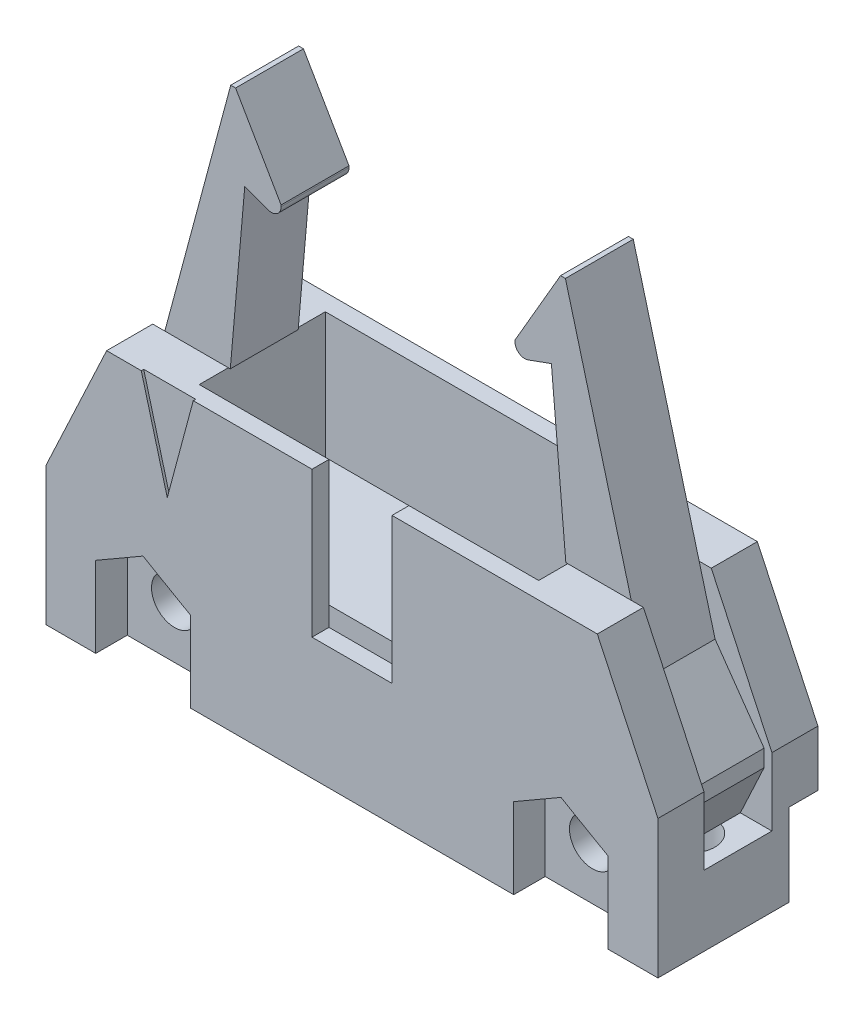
SolidWorks part; units mm, degrees
ref_plane "Front Plane" through (0, 0, 0) normal (0, 0, 1) x (1, 0, 0)
ref_plane "Top Plane" through (0, 0, 0) normal (0, 1, 0) x (1, 0, 0)
ref_plane "Right Plane" through (0, 0, 0) normal (1, 0, 0) x (0, 0, -1)
sketch "Sketch1" plane through (0, 0, 0) normal (0, 0, 1) x (1, 0, 0)
  line L1 (0, 0) -> (32.0548, 0)
  line L2 (0, 0) -> (0, 14.0208)
  line L3 (0, 14.0208) -> (32.0548, 14.0208)
  line L4 (32.0548, 0) -> (32.0548, 14.0208)
  dimension "D1" = 32.0548
  dimension "D2" = 14.0208
extrude "Base-Extrude" add sketch "Sketch1" against normal blind 8.382
sketch "Sketch2" plane through (0, 0, 0) normal (0, 0, 1) x (1, 0, 0)
  line L0 (16.0274, 14.0208) -> (16.0274, 0) construction
  line L1 (32.0548, 14.0208) -> (0, 14.0208) construction
  line L2 (0, 0) -> (32.0548, 0) construction
  line L3 (3.175, 14.0208) -> (0, 7.239)
  line L4 (0, 14.0208) -> (0, 0) construction
  line L5 (0, 14.0208) -> (0, 7.239)
  line L6 (0, 14.0208) -> (3.175, 14.0208)
  line L7 (32.0548, 14.0208) -> (28.8798, 14.0208)
  line L8 (32.0548, 14.0208) -> (32.0548, 7.239)
  line L9 (28.8798, 14.0208) -> (32.0548, 7.239)
  dimension "D1" = 7.239
  dimension "D2" = 3.175
extrude "Angle Cut Outside" cut sketch "Sketch2" against normal through all
sketch "Sketch3" plane through (0, 14.0208, 0) normal (0, 1, 0) x (-1, 0, 0)
  line L4 (-3.175, -4.191) -> (-28.8798, -4.191) construction
  line L5 (-3.175, -8.382) -> (-3.175, 0) construction
  line L6 (-28.8798, -8.382) -> (-28.8798, 0) construction
  line L7 (-16.0274, 0) -> (-16.0274, -8.382) construction
  line L8 (-28.8798, 0) -> (-3.175, 0) construction
  line L9 (-28.8798, -8.382) -> (-3.175, -8.382) construction
  line L10 (-7.1374, -7.493) -> (-7.1374, -0.889)
  line L11 (-7.1374, -0.889) -> (-24.9174, -0.889)
  line L12 (-24.9174, -7.493) -> (-24.9174, -0.889)
  line L13 (-7.1374, -7.493) -> (-24.9174, -7.493)
  point P16 (-16.0274, -0.889)
  point P18 (-24.9174, -4.191)
  point P19 (-7.1374, -4.191)
  dimension "D1" = 3.302
  dimension "D2" = 8.89
extrude "Inside Cut1" cut sketch "Sketch3" against normal blind 6.604
sketch "Sketch4" plane through (0, 0, 0) normal (0, 0, 1) x (1, 0, 0)
  line L0 (16.0274, 0) -> (16.0274, 14.0208) construction
  line L1 (0, 0) -> (32.0548, 0) construction
  line L2 (28.8798, 14.0208) -> (3.175, 14.0208) construction
  line L3 (13.9319, 14.0208) -> (13.9319, 6.4008)
  line L4 (13.9319, 6.4008) -> (18.1229, 6.4008)
  line L5 (13.9319, 14.0208) -> (18.1229, 14.0208)
  line L6 (18.1229, 14.0208) -> (18.1229, 6.4008)
  point P11 (16.0274, 6.4008)
  dimension "D1" = 2.0955
  dimension "D2" = 7.62
extrude "Center Cut1" cut sketch "Sketch4" against normal blind 0.889
ref_plane "Latch Plane" through (0, 0, -2.413) normal (0, 0, 1) x (1, 0, 0)
sketch "Sketch7" plane through (0, 0, -2.413) normal (0, 0, 1) x (1, 0, 0)
  line L0 (16.0274, 0) -> (16.0274, 14.0208) construction
  line L1 (0, 0) -> (32.0548, 0) construction
  line L2 (24.9174, 14.0208) -> (7.1374, 14.0208) construction
  line L3 (24.0591, 22.6702) -> (24.8158, 14.0208)
  line L4 (13.9319, 14.0208) -> (3.175, 14.0208) construction
  line L5 (7.239, 14.0208) -> (3.81, 14.0208)
  line L6 (3.81, 14.0208) -> (7.2614, 26.9014)
  line L7 (7.2614, 26.9014) -> (7.5154, 26.9014)
  line L8 (7.5154, 26.9014) -> (9.9007, 22.7878)
  line L9 (9.9007, 22.7878) -> (9.9007, 22.7024)
  line L10 (9.219, 22.225) -> (7.9957, 22.6702)
  line L11 (7.9957, 22.6702) -> (7.239, 14.0208)
  line L12 (22.8358, 22.225) -> (24.0591, 22.6702)
  line L13 (22.1541, 22.7878) -> (22.1541, 22.7024)
  line L14 (24.5394, 26.9014) -> (22.1541, 22.7878)
  line L15 (24.7934, 26.9014) -> (24.5394, 26.9014)
  line L16 (28.2448, 14.0208) -> (24.7934, 26.9014)
  line L17 (24.8158, 14.0208) -> (28.2448, 14.0208)
  arc A0 (9.219, 22.225) -> (9.9007, 22.7024) centre (9.3927, 22.7024) ccw
  arc A1 (22.8358, 22.225) -> (22.1541, 22.7024) centre (22.6621, 22.7024) cw
  dimension "D9" = 0.508
  dimension "D1" = 0.635
  dimension "D2" = 13.335
  dimension "D3" = 75
  dimension "D4" = 3.429
  dimension "D5" = 22.225
  dimension "D6" = 85
  dimension "D7" = 0.254
  dimension "D8" = 1.905
  dimension "D10" = 0.762
  dimension "D11" = 75
extrude "Latches" add sketch "Sketch7" against normal blind 3.556
sketch "Sketch8" plane through (0, 0, -2.413) normal (0, 0, 1) x (1, 0, 0)
  line L0 (7.2614, 26.9014) -> (3.81, 14.0208) construction
  line L1 (3.81, 14.0208) -> (2.9747, 10.9033)
  line L2 (16.0274, 0) -> (16.0274, 14.0208) construction
  line L3 (0, 0) -> (32.0548, 0) construction
  line L4 (13.9319, 14.0208) -> (3.175, 14.0208) construction
  line L5 (0.4089, 7.239) -> (2.9747, 10.9033)
  line L6 (0.4089, 7.239) -> (0.4089, 6.35)
  line L7 (1.6525, 3.683) -> (0, 3.683)
  line L8 (0, 7.239) -> (0, 0) construction
  line L9 (0.4089, 6.35) -> (1.6525, 3.683)
  line L10 (0, 7.239) -> (0, 3.683)
  line L11 (0, 7.239) -> (3.175, 14.0208) construction
  line L12 (0, 7.239) -> (3.175, 14.0208)
  line L13 (3.81, 14.0208) -> (3.175, 14.0208)
  line L14 (28.2448, 14.0208) -> (28.8798, 14.0208)
  line L15 (32.0548, 7.239) -> (28.8798, 14.0208)
  line L16 (32.0548, 7.239) -> (32.0548, 3.683)
  line L17 (31.6459, 6.35) -> (30.4023, 3.683)
  line L18 (30.4023, 3.683) -> (32.0548, 3.683)
  line L19 (31.6459, 7.239) -> (31.6459, 6.35)
  line L20 (31.6459, 7.239) -> (29.0801, 10.9033)
  line L21 (28.2448, 14.0208) -> (29.0801, 10.9033)
  dimension "D1" = 3.683
  dimension "D2" = 1.6525
  dimension "D3" = 6.35
  dimension "D4" = 65
  dimension "D5" = 160
extrude "Latch Cut1" cut sketch "Sketch8" against normal blind 3.556
sketch "Sketch9" plane through (0, 0, 0) normal (0, 0, 1) x (1, 0, 0)
  line L0 (4.9888, 14.0208) -> (6.35, 8.9408)
  line L1 (13.9319, 14.0208) -> (3.175, 14.0208) construction
  line L2 (6.35, 8.9408) -> (7.7112, 14.0208)
  line L3 (7.7112, 14.0208) -> (4.9888, 14.0208)
  line L4 (6.35, 14.0208) -> (6.35, 0) construction
  line L5 (0, 0) -> (32.0548, 0) construction
  dimension "D1" = 30
  dimension "D2" = 6.35
  dimension "D3" = 5.08
extrude "Pin 1 Triangle Cut" cut sketch "Sketch9" against normal blind 0.127
sketch "Sketch10" plane through (0, 0, 0) normal (0, 0, 1) x (1, 0, 0)
  line L0 (16.0274, 0) -> (16.0274, 14.0208) construction
  line L1 (0, 0) -> (32.0548, 0) construction
  line L2 (24.9174, 14.0208) -> (7.1374, 14.0208) construction
  line L3 (5.9524, 0.4381) -> (7.3994, 1.2735)
  line L4 (2.271, 1.5562) -> (3.718, 0.7208)
  line L5 (7.5565, 0) -> (7.5565, 4.2238)
  line L6 (7.5565, 4.2238) -> (5.08, 5.6536)
  line L7 (5.08, 5.6536) -> (2.6035, 4.2238)
  line L8 (2.6035, 4.2238) -> (2.6035, 0)
  line L9 (2.6035, 0) -> (7.5565, 0)
  line L10 (29.4513, 0) -> (24.4983, 0)
  line L11 (29.4513, 4.2238) -> (29.4513, 0)
  line L12 (26.9748, 5.6536) -> (29.4513, 4.2238)
  line L13 (24.4983, 4.2238) -> (26.9748, 5.6536)
  line L14 (24.4983, 0) -> (24.4983, 4.2238)
  circle A0 centre (5.08, 2.794) radius 2.4765 construction
  circle A1 centre (26.9748, 2.794) radius 2.4765 construction
  dimension "D1" = 4.953
  dimension "D2" = 2.794
  dimension "D3" = 5.08
  dimension "D4" = 10.9474
extrude "Screw Recess" cut sketch "Sketch10" against normal blind 1.651
sketch "Sketch12" plane through (0, 0, 0) normal (0, 0, 1) x (1, 0, 0)
  line L0 (16.0274, 0) -> (16.0274, 14.0208) construction
  line L1 (7.5565, 0) -> (24.4983, 0) construction
  line L2 (24.9174, 14.0208) -> (7.1374, 14.0208) construction
  circle A0 centre (5.08, 2.794) radius 1.2065
  circle A1 centre (26.9748, 2.794) radius 1.2065
  dimension "D1" = 2.413
extrude "Screw Hole" cut sketch "Sketch12" against normal through all
sketch "Sketch13" plane through (0, 0, 0) normal (0, -1, 0) x (1, 0, 0)
  line L0 (16.0274, -8.382) -> (16.0274, 0) construction
  line L1 (0, -8.382) -> (32.0548, -8.382) construction
  line L2 (7.5565, 0) -> (24.4983, 0) construction
  line L3 (0, -8.382) -> (0, 0) construction
  circle A0 centre (2.032, -3.7338) radius 1.27
  circle A1 centre (30.0228, -3.7338) radius 1.27
  dimension "D1" = 2.54
  dimension "D2" = 3.7338
  dimension "D3" = 2.032
  dimension "D4" = 13.9954
extrude "Vert Mnt Hole" cut sketch "Sketch13" against normal up to surface (3.683 mm away)
sketch "Sketch15" plane through (0, 0, -8.382) normal (0, 0, -1) x (-1, 0, 0)
  line L0 (-16.0274, 0) -> (-16.0274, 14.0208) construction
  line L1 (0, 0) -> (-32.0548, 0) construction
  line L2 (-28.8798, 14.0208) -> (-3.175, 14.0208) construction
  line L3 (1.2446, 0) -> (1.2446, 4.318)
  line L4 (1.2446, 4.318) -> (-33.2994, 4.318)
  line L5 (-33.2994, 0) -> (1.2446, 0)
  line L6 (-33.2994, 0) -> (-33.2994, 4.318)
  point P10 (-16.0274, 4.318)
  dimension "D1" = 17.272
  dimension "D2" = 4.318
extrude "R Ang Rear Cut1" cut sketch "Sketch15" against normal blind 1.524
ref_plane "Plane1" through (16.0274, 0, 0) normal (-1, 0, 0) x (0, 0, 1)
